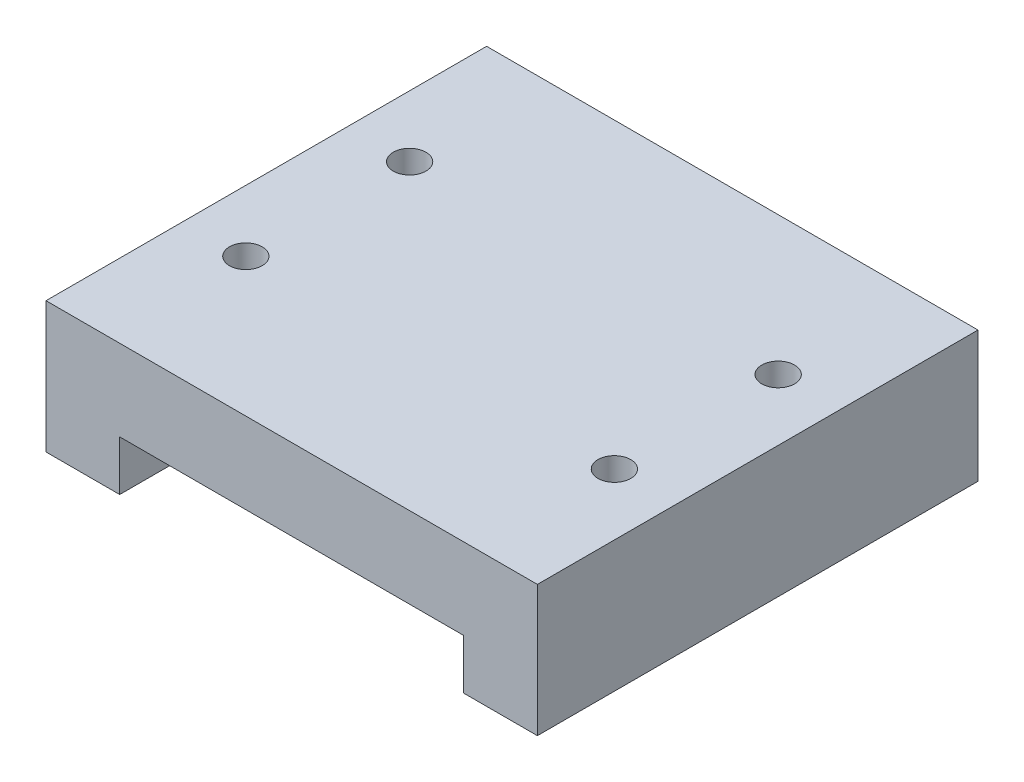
SolidWorks part; units mm, degrees
ref_plane "前基準面" through (0, 0, 0) normal (0, 0, 1) x (1, 0, 0)
ref_plane "上基準面" through (0, 0, 0) normal (0, 1, 0) x (1, 0, 0)
ref_plane "右基準面" through (0, 0, 0) normal (1, 0, 0) x (0, 0, -1)
sketch "草圖1" plane through (0, 0, 0) normal (0, 0, 1) x (1, 0, 0)
  line L0 (0, 8) -> (0, -8) construction
  line L1 (-30, 8) -> (30, 8)
  line L2 (-30, 8) -> (-30, -8)
  line L3 (-30, -8) -> (30, -8)
  line L4 (30, 8) -> (30, -8)
  line L5 (-30, 8) -> (30, -8) construction
  line L6 (-30, -8) -> (30, 8) construction
  line L7 (-21, -8) -> (-21, -1.9)
  line L8 (-21, -1.9) -> (21, -1.9)
  line L9 (21, -8) -> (21, -1.9)
  line L10 (-21, -8) -> (21, -8)
  point P0 (0, 0)
  point P12 (0, -1.9)
  dimension "D1" = 60
  dimension "D2" = 16
  dimension "D3" = 9
  dimension "D4" = 6.1
extrude "填料-伸長1" add sketch "草圖1" along normal blind 53.8 contours L9 L3 L4 L1 L2 L7 L8
sketch "草圖2" plane through (0, 8, 0) normal (0, 1, 0) x (1, 0, 0)
  line L0 (0, 0) -> (0, -53.8) construction
  line L1 (-30, -53.8) -> (30, -53.8) construction
  line L2 (-22.5, 0) -> (-22.5, -53.8) construction
  line L3 (-30, 0) -> (30, 0) construction
  line L4 (-30, -53.8) -> (-30, 0) construction
  line L5 (-30, -26.9) -> (30, -26.9) construction
  line L6 (30, -53.8) -> (30, 0) construction
  line L7 (-28.4, 0) -> (-28.4, -53.8) construction
  circle A0 centre (-22.5, -16.9) radius 2
  circle A1 centre (-22.5, -36.9) radius 2
  circle A2 centre (22.5, -36.9) radius 2
  circle A3 centre (22.5, -16.9) radius 2
  dimension "D2" = 4
  dimension "D6" = 16.9
  dimension "D1" = 22.5
  dimension "D3" = 10
  dimension "D4" = 7.5
  dimension "D5" = 1.6
extrude "除料-伸長1" cut sketch "草圖2" against normal blind 4.2
